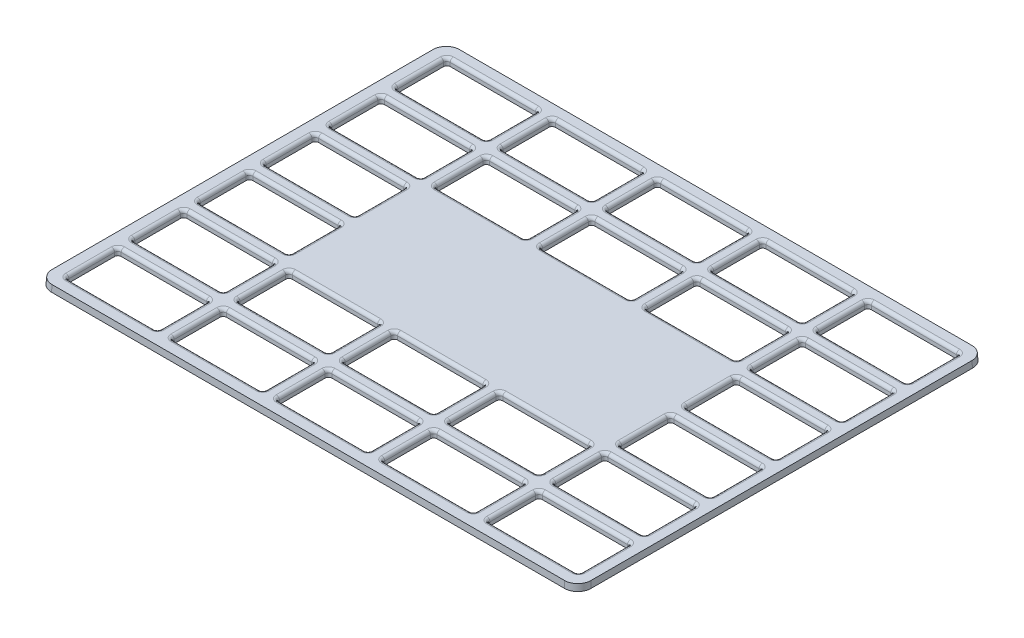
SolidWorks part; units mm, degrees
ref_plane "Front" through (0, 0, 0) normal (0, 0, 1) x (1, 0, 0)
ref_plane "Top" through (0, 0, 0) normal (0, 1, 0) x (1, 0, 0)
ref_plane "Right" through (0, 0, 0) normal (1, 0, 0) x (0, 0, -1)
sketch "Sketch1" plane through (0, 0, 0) normal (0, 1, 0) x (1, 0, 0)
  line L1 (0, 0) -> (260.35, 0)
  line L2 (0, 0) -> (0, 196.85)
  line L3 (0, 196.85) -> (260.35, 196.85)
  line L4 (260.35, 0) -> (260.35, 196.85)
  dimension "D1" = 260.35
  dimension "D2" = 196.85
extrude "Extrude1" add sketch "Sketch1" along normal blind 3.175 draft 3
fillet "Fillet3" radius 6.35 4 edges at (0.0832, 1.5875, -196.7668) (260.2668, 1.5875, -196.7668) (260.2668, 1.5875, -0.0832) (0.0832, 1.5875, -0.0832)
sketch "Sketch2" plane through (0, 3.175, 0) normal (0, 1, 0) x (-1, 0, 0)
  line L0 (-0.1664, -190.3423) -> (-0.1664, -6.5077) construction
  line L1 (-6.5164, -6.5164) -> (-50.9664, -6.5164)
  line L2 (-6.5164, -6.5164) -> (-6.5164, -31.9164)
  line L3 (-6.5164, -31.9164) -> (-50.9664, -31.9164)
  line L4 (-50.9664, -6.5164) -> (-50.9664, -31.9164)
  line L5 (-6.5077, -0.1664) -> (-253.8423, -0.1664) construction
  dimension "D1" = 6.35
  dimension "D2" = 6.35
  dimension "D3" = 44.45
  dimension "D4" = 25.4
extrude "Cut-Extrude1" cut sketch "Sketch2" against normal through all draft 3
fillet "Fillet1" radius 1.5875 4 edges at (50.8832, 1.5875, -31.8332) (50.8832, 1.5875, -6.5996) (6.5996, 1.5875, -6.5996) (6.5996, 1.5875, -31.8332)
fillet "Fillet2" radius 1.5875 8 edges at (6.9805, 3.175, -6.9805) (6.5164, 3.175, -19.2164) (6.9805, 3.175, -31.4523) (28.7414, 3.175, -31.9164) (50.5023, 3.175, -31.4523) (50.9664, 3.175, -19.2164) (50.5023, 3.175, -6.9805) (28.7414, 3.175, -6.5164)
pattern_linear "LPattern1" count 5 spacing 50.8 along (1, 0, 0) count 6 spacing 31.75 along (0, 0, -1) of "Cut-Extrude1", "Fillet1", "Fillet2"
